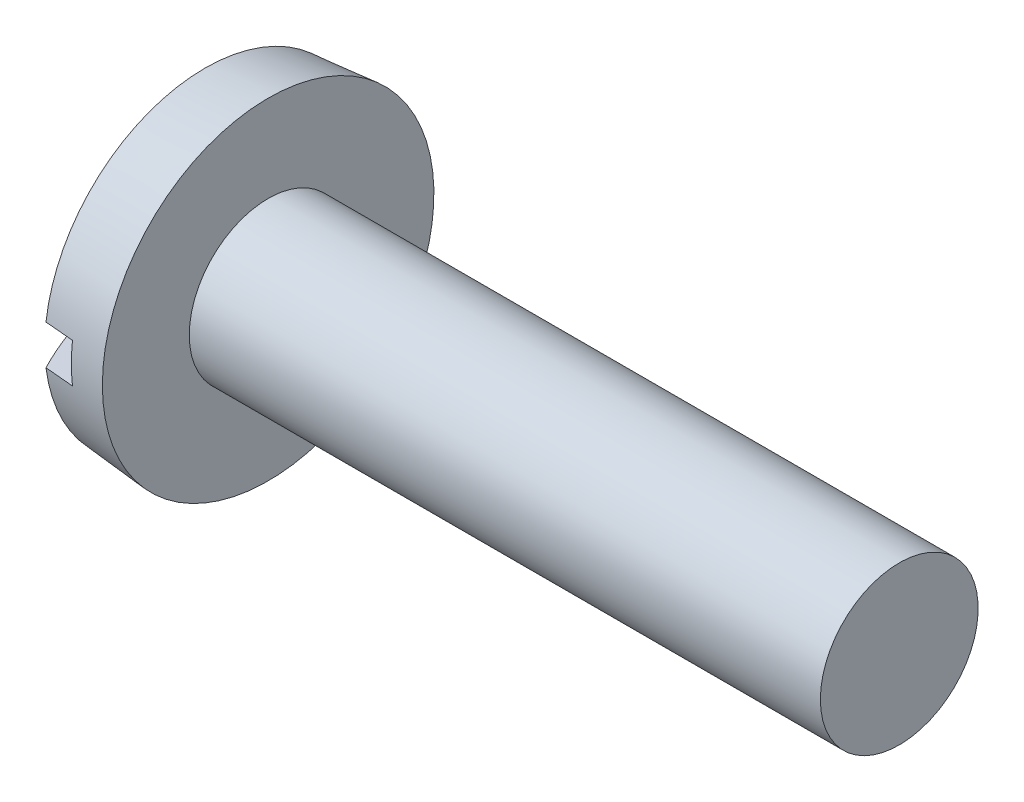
SolidWorks part; units mm, degrees
ref_plane "Plane1" through (0, 0, 0) normal (0, 0, 1) x (1, 0, 0)
ref_plane "Plane2" through (0, 0, 0) normal (0, 1, 0) x (1, 0, 0)
ref_plane "Plane3" through (0, 0, 0) normal (1, 0, 0) x (0, 0, -1)
sketch "BodySke" plane through (0, 0, 0) normal (0, 0, 1) x (1, 0, 0)
  line L0 (6.1976, 4.7625) -> (6.1976, 10.0076)
  line L1 (6.1976, 10.0076) -> (2.3876, 9.6743)
  line L2 (-25.4, 0) -> (127, 0) construction
  line L3 (6.1976, -10.0076) -> (2.3876, -9.6743) construction
  line L4 (6.1976, 4.7625) -> (44.2976, 4.7625)
  line L5 (44.2976, 4.7625) -> (44.2976, 0)
  line L6 (44.2976, 0) -> (0, 0)
  line L7 (6.1976, -4.7625) -> (44.2976, -4.7625) construction
  line L8 (7.7851, 6.35) -> (7.7851, -3.175) construction
  line L9 (18.8976, 6.35) -> (18.8976, -3.175) construction
  arc A0 (0, 0) -> (2.3876, 9.6743) centre (20.7933, 0) cw
  dimension "Head_ang" = 85
  dimension "Oval_ht" = 2.3876
  dimension "Head_ht" = 6.1976
  dimension "Diameter" = 9.525
  dimension "Length" = 38.1
  dimension "Head_dia" = 20.0152
  dimension "Advance" = 1.5875
  dimension "Thread_nom" = 25.4
revolve "Base-Revolve" add sketch "BodySke" angle 360 about L2
sketch "Sketch2" plane through (0, 0, 0) normal (1, 0, 0) x (0, 0, -1)
  line L0 (10.0076, -1.1938) -> (10.0076, 1.1938)
  line L1 (10.0076, 1.1938) -> (-10.0076, 1.1938)
  line L2 (-10.0076, 1.1938) -> (-10.0076, -1.1938)
  line L3 (-10.0076, -1.1938) -> (10.0076, -1.1938)
  dimension "D1" = 20.0152
  dimension "D2" = 10.0076
  dimension "D3" = 1.1938
  dimension "Slot_width" = 2.3876
extrude "Slot" cut sketch "Sketch2" along normal blind 4.1402
sketch "Sketch3" plane through (0, 0, 0) normal (1, 0, 0) x (0, 0, -1)
  line L0 (-1.0287, 6.096) -> (1.0287, 6.096)
  line L1 (1.0287, 6.096) -> (1.0287, -6.096)
  line L2 (1.0287, -6.096) -> (-1.0287, -6.096)
  line L3 (-1.0287, -6.096) -> (-1.0287, 6.096)
  dimension "D1" = 1.0287
  dimension "Cross_width" = 2.0574
  dimension "D2" = 6.096
  dimension "Cross_dia" = 12.192
ref_plane "Plane4" through (7.2644, 0, 0) normal (1, 0, 0) x (0, 0, -1)
sketch "Sketch4" plane through (7.2644, 0, 0) normal (1, 0, 0) x (0, 0, -1)
  line L0 (-0.5143, 0.5143) -> (0.5143, 0.5143)
  line L1 (0.5143, 0.5143) -> (0.5144, -0.5143)
  line L2 (0.5144, -0.5143) -> (-0.5143, -0.5144)
  line L3 (-0.5143, -0.5144) -> (-0.5143, 0.5143)
  dimension "D1" = 1.0287
  dimension "D2" = 0.5143
  dimension "D3" = 1.0287
  dimension "D4" = 0.5143
loft "Cross" cut profiles "Sketch3", "Sketch4"
pattern_circular "CirPattern1" count 2 every 90 about axis through (0, 0, 0) along (1, 0, 0) of "Cross"
sketch "ThdSchSke" plane through (0, 0, 0) normal (0, 0, 1) x (1, 0, 0)
  line L0 (18.8976, -3.9688) -> (18.3418, -4.7625)
  line L1 (18.8976, -3.9688) -> (19.4534, -4.7625)
  line L2 (19.4534, -4.7625) -> (19.4534, -5.9531)
  line L3 (-3.175, 0) -> (5.1513, 0) construction
  line L5 (19.4534, -5.9531) -> (18.3418, -5.9531)
  line L6 (18.3418, -5.9531) -> (18.3418, -4.7625)
  dimension "Thread_minor" = 7.9375
  dimension "Diameter" = 9.525
  dimension "Start" = 18.8976
  dimension "SideAngle" = 55
  dimension "VeeAngle" = 70
  dimension "Overcut" = 11.9063
revolve "ThreadSchematic" [suppressed] cut sketch "ThdSchSke" angle 360 about L3
pattern_linear "ThdSchPat" [suppressed]
equation "\"D1@Sketch3\" = \"Cross_width@Sketch3\" / 2"
equation "\"D2@Sketch3\" = \"Cross_dia@Sketch3\" / 2"
equation "\"D1@Sketch4\" = \"Cross_width@Sketch3\"*.5"
equation "\"D2@Sketch4\" = \"D1@Sketch4\" / 2"
equation "\"D3@Sketch4\" = \"D1@Sketch4\""
equation "\"D4@Sketch4\" = \"D2@Sketch4\""
equation "\"D1@Sketch2\" = \"Head_dia@BodySke\""
equation "\"D2@Sketch2\" = \"D1@Sketch2\" / 2"
equation "\"D3@Sketch2\" = \"Slot_width@Sketch2\" / 2"
equation "\"Thread_length@ThreadCosmetic\" = ((sgn( (\"Length@BodySke\" - \"Advance@BodySke\" ) - \"Thread_nom@BodySke\" )-1)*( (\"Length@BodySke\" - \"Advance@BodySke\" ) - \"Thread_nom@BodySke\" ))/-2+ \"Thread_nom@BodySke\""
equation "\"Thread_minor@ThdSchSke\" = \"Thread_minor@ThreadCosmetic\""
equation "\"Diameter@ThdSchSke\" = \"Diameter@BodySke\""
equation "\"Overcut@ThdSchSke\" = \"Diameter@BodySke\" * 1.25"
equation "\"Start@ThdSchSke\" = \"Head_ht@BodySke\" + \"Length@BodySke\" - \"Thread_length@ThreadCosmetic\"  '---Non-countersunk---"
equation "\"Num_threads@ThdSchPat\" = int( \"Thread_length@ThreadCosmetic\" / \"Advance@BodySke\" + 0.999 )  + 1"
equation "\"Advance@ThdSchPat\" = \"Thread_length@ThreadCosmetic\" /  (\"Num_threads@ThdSchPat\" - 1) 'relax it"
